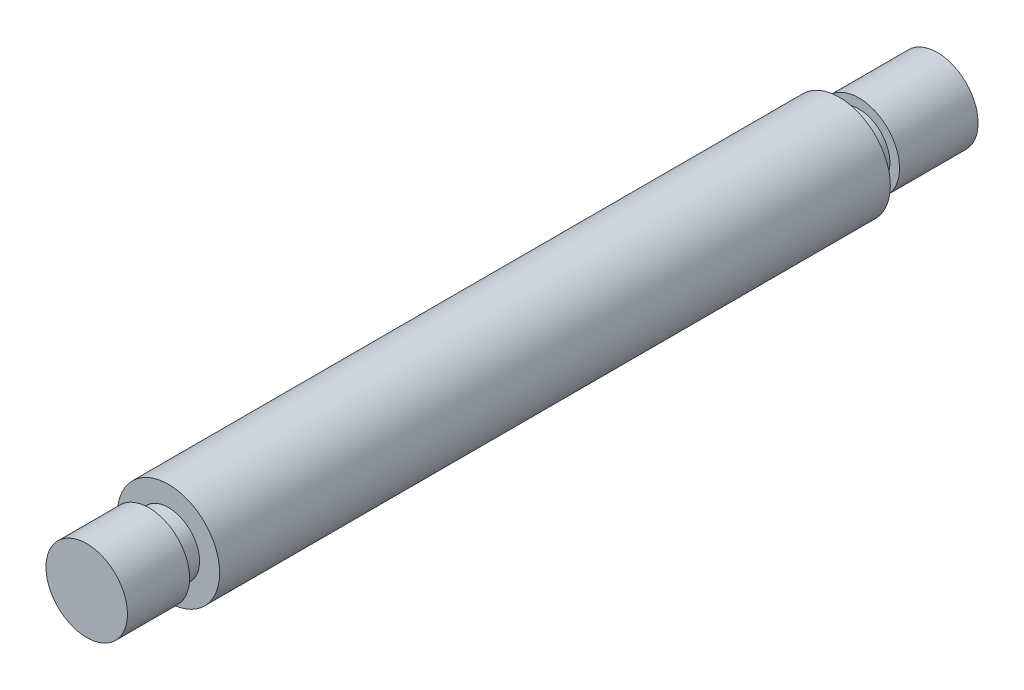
SolidWorks part; units mm, degrees
ref_plane "Front" through (0, 0, 0) normal (0, 0, 1) x (1, 0, 0)
ref_plane "Top" through (0, 0, 0) normal (0, 1, 0) x (1, 0, 0)
ref_plane "Right" through (0, 0, 0) normal (1, 0, 0) x (0, 0, -1)
sketch "Sketch1" plane through (0, 0, 0) normal (0, 0, 1) x (1, 0, 0)
  circle A0 centre (0, 0) radius 7.62
  dimension "D1" = 15.24
extrude "Extrude1" add sketch "Sketch1" along normal blind 6.35
sketch "Sketch2" plane through (0, 0, 0) normal (0, 0, -1) x (-1, 0, 0)
  circle A0 centre (0, 0) radius 3.9688
  dimension "D1" = 7.9375
extrude "Extrude2" add sketch "Sketch2" along normal blind 59.69
hole_wizard "#18 (0.169500) Diameter Hole1" positions "Sketch4" profile "Sketch3" hole size "#18" standard "Ansi Inch"
sketch "Sketch4" plane through (0, 0, 6.35) normal (0, 0, 1) x (1, 0, 0)
  point P0 (0, 0)
sketch "Sketch3" plane through (0, 0, 6.35) normal (1, 0, 0) x (0, -1, 0)
  line L0 (0, 0) -> (0, 67.31)
  line L1 (0, 67.31) -> (2.1526, 67.31)
  line L2 (2.1526, 67.31) -> (2.1526, 0)
  line L5 (2.1526, 0) -> (0, 0)
  line L11 (0, -6.35) -> (0, 107.95) construction
  dimension "Thru Hole Dia." = 4.3053
  dimension "Thru Hole Depth" = 67.31
sketch "Sketch6" plane through (0, 0, 0) normal (0, 1, 0) x (1, 0, 0)
  line L0 (3.9688, 52.07) -> (2.413, 52.07)
  line L1 (3.9688, 0) -> (3.9688, 59.69) construction
  line L2 (2.413, 52.07) -> (2.413, 53.594)
  line L3 (2.413, 53.594) -> (3.1623, 53.594)
  line L4 (3.1623, 53.594) -> (3.1623, 59.69)
  line L5 (3.9688, 59.69) -> (-3.9688, 59.69) construction
  line L6 (3.1623, 59.69) -> (3.9688, 59.69)
  line L7 (3.9688, 59.69) -> (3.9688, 52.07)
  line L8 (0, 59.69) -> (0, 49.6007) construction
  dimension "D1" = 6.3246
  dimension "D2" = 4.826
  dimension "D3" = 1.524
  dimension "D4" = 7.62
revolve "1/4-28 Thread 1" cut sketch "Sketch6" angle 360 about L8
sketch "Sketch7" plane through (0, 0, 0) normal (0, 1, 0) x (1, 0, 0)
  line L0 (7.62, -6.35) -> (7.62, 0)
  line L1 (-7.62, -6.35) -> (7.62, -6.35) construction
  line L2 (7.62, 0) -> (-7.62, 0) construction
  line L3 (7.62, 0) -> (2.413, 0)
  line L4 (3.9688, 0) -> (-3.9688, 0) construction
  line L5 (2.413, 0) -> (2.413, -1.524)
  line L6 (2.413, -1.524) -> (3.1623, -1.524)
  line L7 (3.1623, -1.524) -> (3.1623, -6.35)
  line L8 (3.1623, -6.35) -> (7.62, -6.35)
  line L9 (0, 0) -> (0, -9.2954) construction
  dimension "D1" = 6.3246
  dimension "D2" = 4.826
  dimension "D3" = 1.524
revolve "1/4-28 Thread 2" cut sketch "Sketch7" angle 360 about L9
